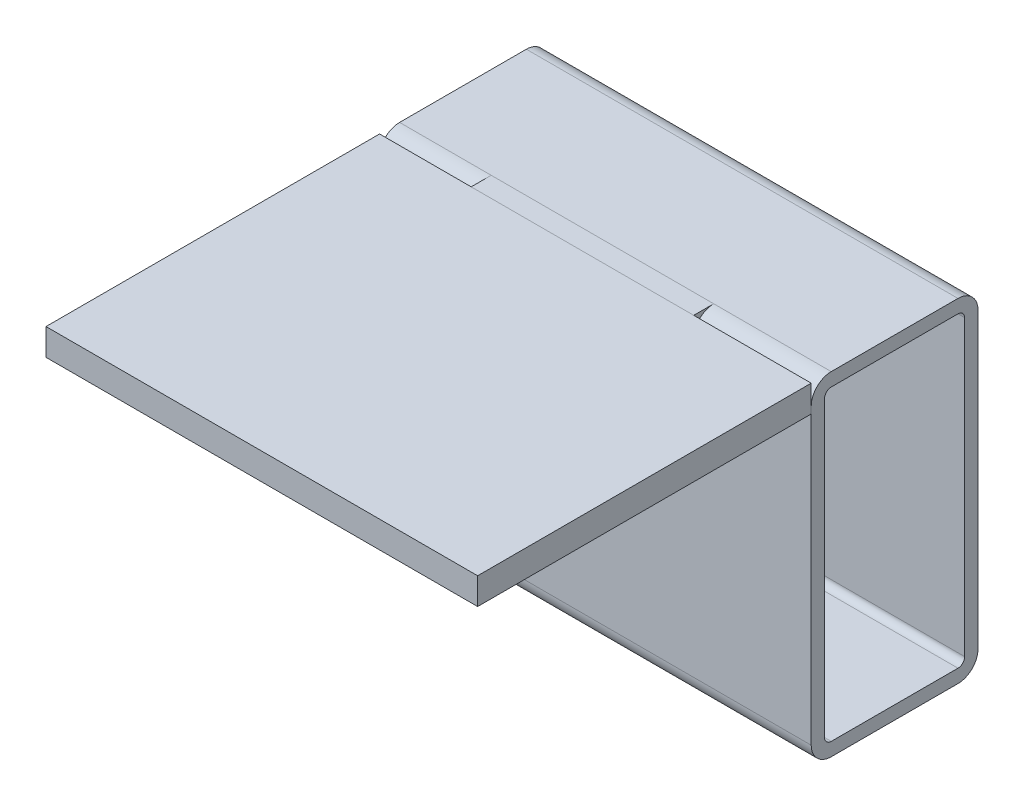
SolidWorks part; units mm, degrees
ref_plane "vorne" through (0, 0, 0) normal (0, 0, 1) x (1, 0, 0)
ref_plane "0.00" through (0, 0, 0) normal (0, 1, 0) x (1, 0, 0)
ref_plane "mitte" through (0, 0, 0) normal (1, 0, 0) x (0, 0, -1)
sketch "Skizze1" plane through (0, 0, 0) normal (0, 1, 0) x (1, 0, 0)
  line L0 (0, 0) -> (-129.399, 0)
  line L1 (-55, 0) -> (55, 0) construction
other "Strukturbauteil1"
ref_plane "Ebene1" through (0, 0, 0) normal (-1, 0, 0) x (0, 1, 0)
sketch "Skizze11" plane through (0, -8, 50) normal (-1, 0, 0) x (0, 0, 1)
  line L0 (0, 0) -> (0, 8) construction
  line L1 (-50, 0) -> (50, 0)
  line L2 (-50, 0) -> (-50, 8)
  line L3 (-50, 8) -> (50, 8)
  line L4 (50, 0) -> (50, 8)
  point P6 (0, 0)
  dimension "D1" = 100
  dimension "D2" = 8
other "Strukturbauteil2"
ref_plane "Ebene2" through (0, 0, 0) normal (-1, 0, 0) x (0, 1, 0)
sketch "Skizze12" plane through (0, -50, -25) normal (-1, 0, 0) x (0, 1, 0)
  line L0 (46, -19) -> (46, 19)
  line L1 (44, -25) -> (-44, -25)
  line L2 (50, -19) -> (50, 19)
  line L3 (44, 25) -> (-44, 25)
  line L4 (-50, -19) -> (-50, 19)
  line L5 (44, 21) -> (-44, 21)
  line L6 (-46, -19) -> (-46, 19)
  line L7 (44, -21) -> (-44, -21)
  line L8 (0, -25) -> (0, 25) construction
  arc A0 (-50, 19) -> (-44, 25) centre (-44, 19) cw
  arc A1 (-44, -25) -> (-50, -19) centre (-44, -19) cw
  arc A2 (50, -19) -> (44, -25) centre (44, -19) cw
  arc A3 (44, 25) -> (50, 19) centre (44, 19) cw
  arc A4 (44, 21) -> (46, 19) centre (44, 19) cw
  arc A5 (-46, 19) -> (-44, 21) centre (-44, 19) cw
  arc A6 (-44, -21) -> (-46, -19) centre (-44, -19) cw
  arc A7 (46, -19) -> (44, -21) centre (44, -19) cw
  point P4 (0, 25)
  point P5 (0, -25)
  point P10 (-50, -25)
  point P13 (50, -25)
  point P16 (50, 25)
  point P25 (-50, -25)
  point P26 (-50, 25)
  point P27 (50, 25)
  point P30 (50, -25)
  point P31 (0, 0)
  point P32 (-50, 0)
  point P33 (50, 0)
  point P34 (0, 0)
  dimension "D3" = 6
  dimension "D1" = 100
  dimension "D2" = 50
  dimension "D4" = 4
sketch "Skizze3" plane through (0, 0, 0) normal (0, 1, 0) x (1, 0, 0)
  line L0 (-129.399, 6) -> (0, 6) construction
  line L1 (-101.9388, 0) -> (-35.2216, 0)
  line L2 (-101.9388, 0) -> (-101.9388, 6)
  line L3 (-101.9388, 6) -> (-35.2216, 6)
  line L4 (-35.2216, 0) -> (-35.2216, 6)
  line L5 (0, 0) -> (-129.399, 0) construction
  line L6 (-129.399, 0) -> (0, 0) construction
extrude "Linear austragen2" add sketch "Skizze3" against normal up to surface (6 mm away) separate body
other "schweissnaht<1>" parameters "Dicke"=1.5
